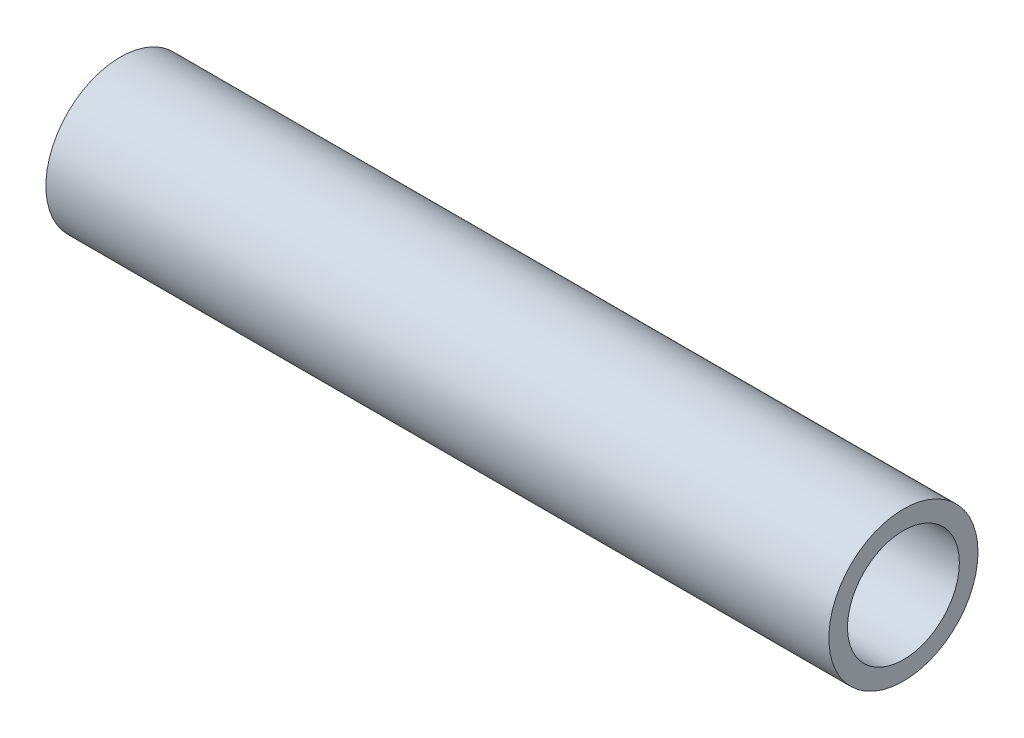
SolidWorks part; units mm, degrees
ref_plane "Plan de face" through (0, 0, 0) normal (0, 0, 1) x (1, 0, 0)
ref_plane "Plan de dessus" through (0, 0, 0) normal (0, 1, 0) x (1, 0, 0)
ref_plane "Plan de droite" through (0, 0, 0) normal (1, 0, 0) x (0, 0, -1)
sketch "Esquisse2" plane through (0, 0, 0) normal (0, 0, 1) x (1, 0, 0)
  line L0 (0, 0) -> (-17.6, 0) construction
  line L1 (0, 4) -> (-42, 4)
  line L2 (0, 4) -> (0, 3)
  line L3 (0, 3) -> (-42, 3)
  line L4 (-42, 4) -> (-42, 3)
  line L5 (-42, 16) -> (-42, -16) construction
  point P7 (0, 0)
  point P8 (0, 0)
  dimension "D1" = 8
  dimension "D2" = 1
revolve "Révolution1" add sketch "Esquisse2" angle 360 about L0
